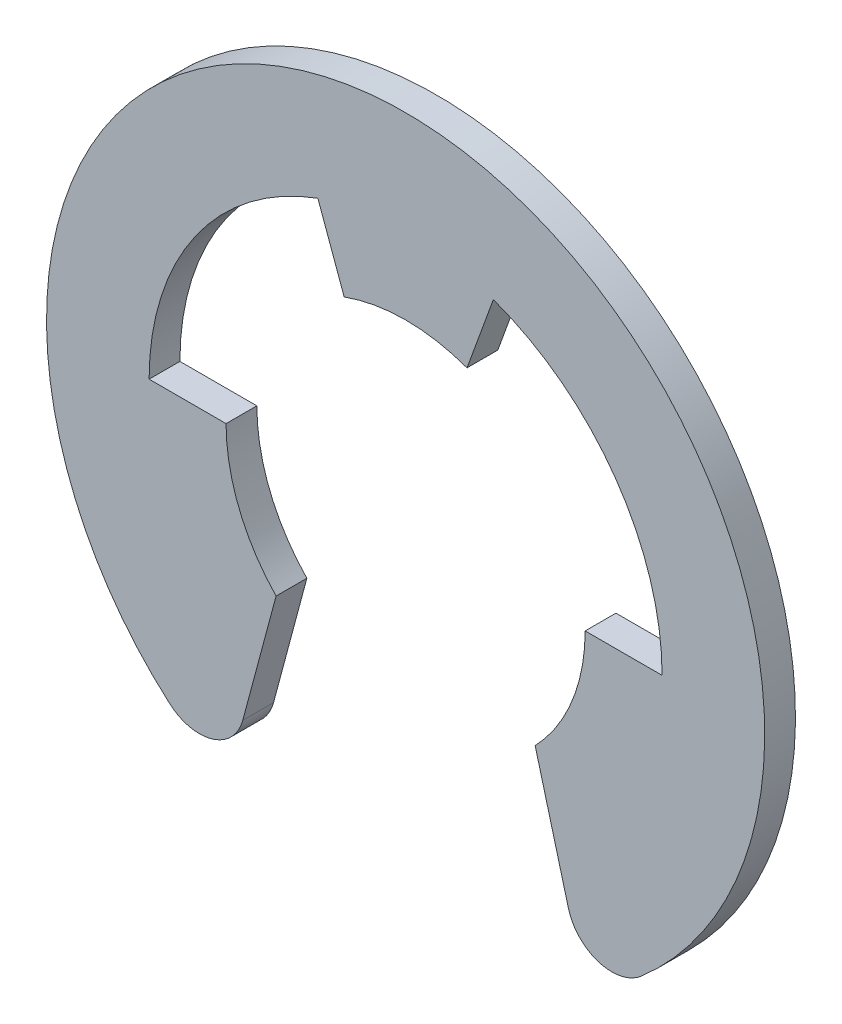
SolidWorks part; units mm, degrees
ref_plane "Plan1" through (0, 0, 0) normal (0, 0, 1) x (1, 0, 0)
ref_plane "Plan2" through (0, 0, 0) normal (0, 1, 0) x (1, 0, 0)
ref_plane "Plan3" through (0, 0, 0) normal (1, 0, 0) x (0, 0, -1)
sketch "Esquisse1" plane through (0, 0, 0) normal (0, 0, 1) x (1, 0, 0)
  line L0 (0, 0) -> (0, 7) construction
  line L1 (1.1971, 3.2889) -> (1.7101, 4.6985)
  line L2 (-1.1971, 3.2889) -> (-1.7101, 4.6985)
  line L3 (-2.5251, -2.4236) -> (-3.1746, -4.8478)
  line L4 (3.5, 0) -> (5, 0)
  line L5 (-5, 0) -> (-3.5, 0)
  line L6 (0, 0) -> (0, -9.9391) construction
  line L7 (2.5251, -2.4236) -> (3.1746, -4.8478)
  arc A0 (4.5941, -5.2815) -> (-4.5941, -5.2815) centre (0, 0) ccw
  arc A1 (-3.5, 0) -> (-2.5251, -2.4236) centre (0, 0) ccw
  arc A2 (-1.7101, 4.6985) -> (-5, 0) centre (0, 0) ccw
  arc A3 (1.1971, 3.2889) -> (-1.1971, 3.2889) centre (0, 0) ccw
  arc A4 (2.5251, -2.4236) -> (3.5, 0) centre (0, 0) ccw
  arc A5 (5, 0) -> (1.7101, 4.6985) centre (0, 0) ccw
  arc A6 (-4.5941, -5.2815) -> (-3.1746, -4.8478) centre (-4.0198, -4.6213) ccw
  arc A7 (3.1746, -4.8478) -> (4.5941, -5.2815) centre (4.0198, -4.6213) ccw
  dimension "D1" = 7
  dimension "D2" = 14
  dimension "D3" = 10
  dimension "D8" = 0.875
  dimension "D4" = 20
  dimension "D5" = 20
  dimension "D6" = 15
  dimension "D7" = 15
extrude "Base-Extrusion" add sketch "Esquisse1" along normal blind 0.6
